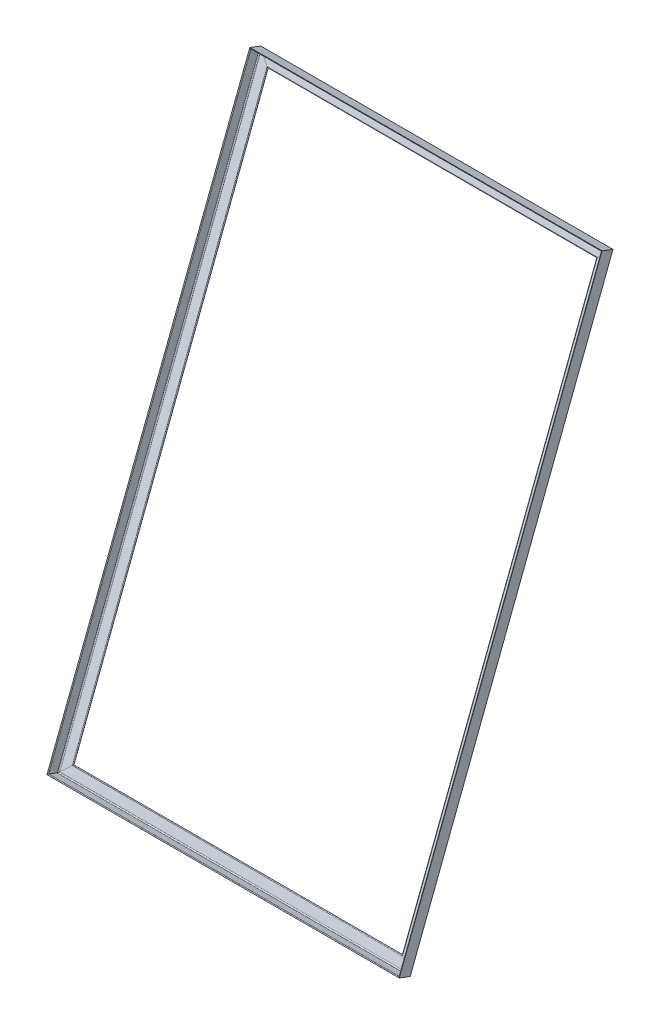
SolidWorks part; units mm, degrees
ref_plane "Front Plane" through (0, 0, 0) normal (0, 0, 1) x (1, 0, 0)
ref_plane "Top Plane" through (0, 0, 0) normal (0, 1, 0) x (1, 0, 0)
ref_plane "Right Plane" through (0, 0, 0) normal (1, 0, 0) x (0, 0, -1)
sketch "Sketch1" plane through (0, 0, 0) normal (1, 0, 0) x (0, 0, -1)
  line L0 (0, 0) -> (0, 4572)
  line L1 (0, 4572) -> (-1755.0384, 0)
  line L2 (-1755.0384, 0) -> (0, 0)
  dimension "D1" = 1755.0384
  dimension "D2" = 4572
sketch "Sketch2" plane through (0, 0, 0) normal (0, 0, 1) x (1, 0, 0)
  line L0 (0, 4572) -> (3158.9789, 4572) construction
ref_plane "Plane1" through (0, 587.1779, 1529.6404) normal (0, -0.3584, -0.9336) x (-1, 0, 0)
sketch "Sketch4" plane through (0, 587.1779, 1529.6404) normal (0, -0.3584, -0.9336) x (-1, 0, 0)
  line L0 (0, 4268.326) -> (0, 1819.6863)
  line L1 (0, 4268.326) -> (-1524, 4268.326)
  line L2 (0, 1819.6863) -> (-1524, 1819.6863)
  line L3 (-1524, 4268.326) -> (-1524, 1819.6863)
  line L4 (0, 1819.6863) -> (0, -628.9533)
  line L5 (0, 1819.6863) -> (-1524, 1819.6863)
  line L6 (0, -628.9533) -> (-1524, -628.9533)
  line L7 (-1524, 1819.6863) -> (-1524, -628.9533)
  dimension "D1" = 1524
other "Angle iron 2 X 2 X 0.125(1)"
ref_plane "Plane2" through (0, 4572, 0) normal (0, -0.9336, 0.3584) x (1, 0, 0)
sketch "Sketch11" plane through (0, 4572, 0) normal (0, -0.9336, 0.3584) x (1, 0, 0)
  line L0 (0, 0) -> (0, 50.8)
  line L1 (0, 50.8) -> (0.0051, 50.8)
  line L2 (3.175, 47.6301) -> (3.175, 7.9375)
  line L3 (7.9375, 3.175) -> (47.6301, 3.175)
  line L4 (50.8, 0.0051) -> (50.8, 0)
  line L5 (50.8, 0) -> (0, 0)
  arc A0 (50.8, 0.0051) -> (47.6301, 3.175) centre (47.6301, 0.0051) ccw
  arc A1 (0.0051, 50.8) -> (3.175, 47.6301) centre (0.0051, 47.6301) cw
  arc A2 (7.9375, 3.175) -> (3.175, 7.9375) centre (7.9375, 7.9375) cw
  point P10 (25.4, 0)
  point P14 (0, 25.4)
  point P15 (3.175, 25.4)
  point P16 (25.4, 3.175)
  point P17 (3.175, 50.8)
  point P18 (50.8, 3.175)
  point P19 (0, 0)
  dimension "D2" = 0.0051
  dimension "Radius_1" = 4.7625
  dimension "D1" = 3.175
  dimension "H_leg" = 50.8
